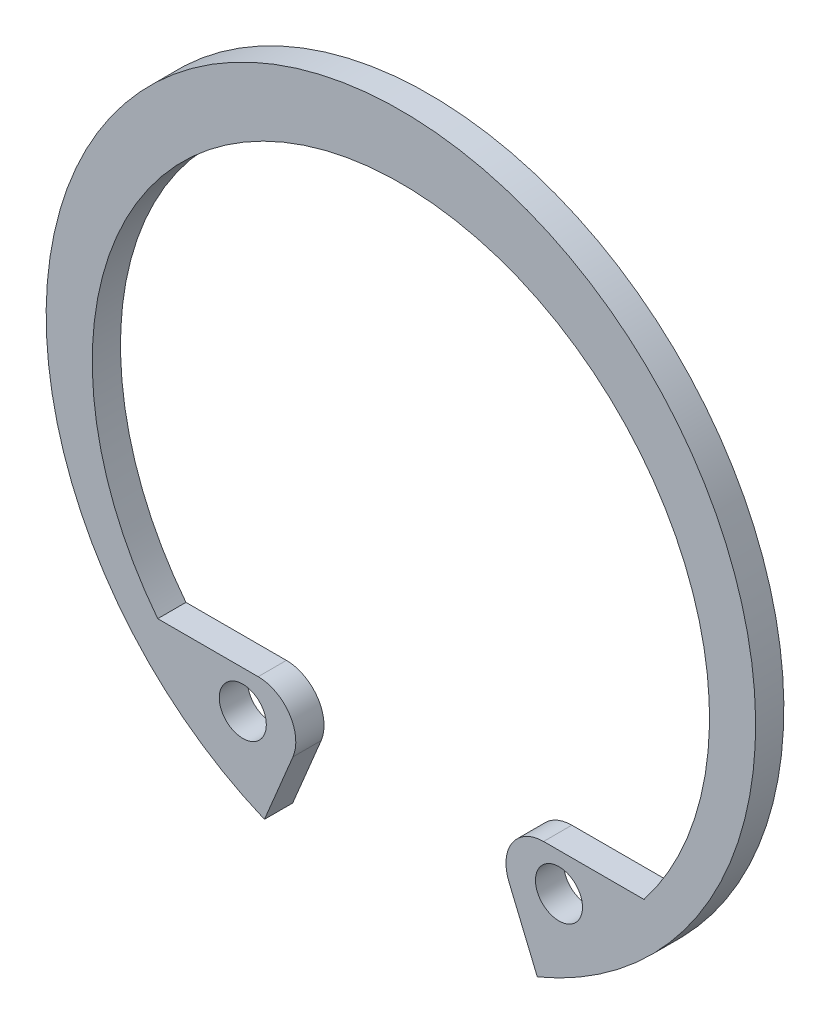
SolidWorks part; units mm, degrees
ref_plane "Face" through (0, 0, 0) normal (0, 0, 1) x (1, 0, 0)
ref_plane "Dessus" through (0, 0, 0) normal (0, 1, 0) x (1, 0, 0)
ref_plane "Droite" through (0, 0, 0) normal (1, 0, 0) x (0, 0, -1)
sketch "Esquisse1" plane through (0, 0, 0) normal (0, 0, 1) x (1, 0, 0)
  line L0 (-12.9209, -11) -> (-7.5833, -11)
  line L1 (0, 0) -> (0, -17.4) construction
  line L2 (-7.25, -17.4) -> (-5.7372, -13.7692)
  line L3 (7.25, -17.4) -> (5.7372, -13.7692)
  line L4 (5.7372, -13.7692) -> (0, 0) construction
  line L5 (-5.7372, -13.7692) -> (0, 0) construction
  line L6 (7.5833, -11) -> (12.9209, -11)
  arc A0 (7.25, -17.4) -> (-7.25, -17.4) centre (0, 0) ccw
  arc A1 (12.9209, -11) -> (-12.9209, -11) centre (0, -0.9) ccw
  arc A2 (5.7372, -13.7692) -> (7.5833, -11) centre (7.5833, -13) cw
  arc A3 (-5.7372, -13.7692) -> (-7.5833, -11) centre (-7.5833, -13) ccw
  circle A4 centre (8.4, -13) radius 1.25
  circle A5 centre (-8.4, -13) radius 1.25
  dimension "D1" = 0.9
  dimension "D2" = 37.7
  dimension "D3" = 14.5
  dimension "D4" = 2.5
  dimension "D7" = 13
  dimension "D8" = 11
  dimension "D5" = 2
  dimension "D6" = 16.8
  dimension "D9" = 16.4
extrude "Extrusion1" add sketch "Esquisse1" along normal blind 1.5
